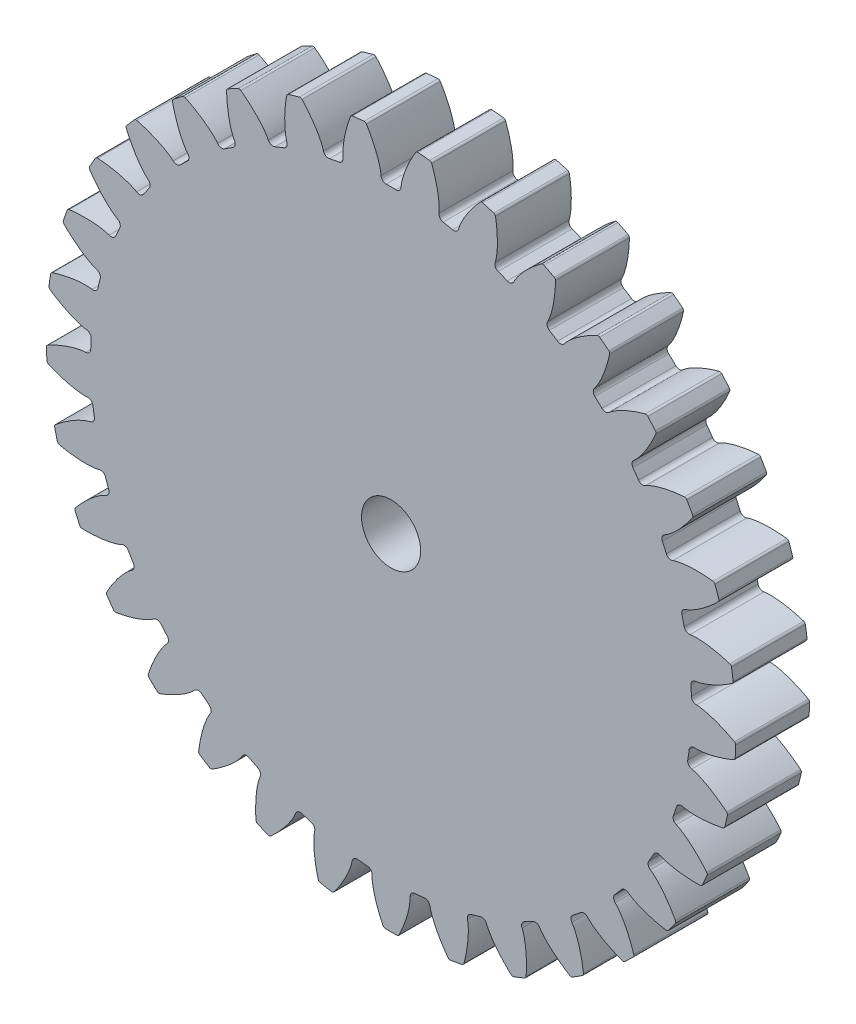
SolidWorks part; units mm, degrees
ref_plane "Front" through (0, 0, 0) normal (0, 0, 1) x (1, 0, 0)
ref_plane "Top" through (0, 0, 0) normal (0, 1, 0) x (1, 0, 0)
ref_plane "Right" through (0, 0, 0) normal (1, 0, 0) x (0, 0, -1)
sketch "Sketch1" plane through (0, 0, 0) normal (0, 0, 1) x (1, 0, 0)
  circle A0 centre (0, 0) radius 29.6333
extrude "Boss-Extrude1" add sketch "Sketch1" along normal blind 6.35
sketch "Sketch3" plane through (0, 0, 0) normal (0, 0, 1) x (1, 0, 0)
  line L0 (0, 0) -> (43.7181, 0) construction
  line L2 (0, 0) -> (-0.8442, 25.8095) construction
  line L3 (0, 0) -> (0.8442, 25.8095) construction
  line L4 (0.8442, 25.8095) -> (0.8583, 26.241) construction
  line L5 (0, 0) -> (0, 61.276) construction
  line L6 (-0.8442, 25.8095) -> (-0.8583, 26.241) construction
  circle A0 centre (0, 0) radius 29.6333 construction
  circle A1 centre (0, 0) radius 27.94 construction
  circle A2 centre (0, 0) radius 26.255 construction
  arc A3 (0.8442, 25.8095) -> (-0.8442, 25.8095) centre (0, 0) ccw construction
  arc A5 (2.1878, 29.5525) -> (-2.1878, 29.5525) centre (0, 0) ccw
  spline S0 degree 4 poles (-0.8583, 26.241) (-0.8585, 26.2463) (-0.8593, 26.2612) (-0.8616, 26.2893) (-0.8664, 26.3351) (-0.874, 26.3935) (-0.8855, 26.4688) (-0.9013, 26.5573) (-0.921, 26.6545) (-0.9449, 26.7599) (-0.9709, 26.865) (-0.999, 26.9696) (-1.0288, 27.0736) (-1.0671, 27.1993) (-1.1161, 27.3497) (-1.1778, 27.525) (-1.253, 27.7232) (-1.3352, 27.9245) (-1.4207, 28.1218) (-1.5123, 28.3205) (-1.6047, 28.5121) (-1.7061, 28.7103) (-1.8024, 28.8929) (-1.9163, 29.0964) (-2.0099, 29.2603) (-2.1397, 29.4754) (-2.2183, 29.6022) (-2.3124, 29.7501) (-2.3553, 29.8155) (-2.3818, 29.8559) knots 0 0 0 0 0 0.005377 0.015084 0.028532 0.04661 0.064855 0.092111 0.119476 0.146842 0.174209 0.201575 0.228941 0.256307 0.307035 0.361767 0.4165 0.471232 0.525964 0.580697 0.635429 0.690161 0.744894 0.799626 0.854358 0.909091 0.954545 1 1 1 1 1 construction
  spline S1 degree 4 poles (-0.8583, 26.241) (-0.8585, 26.2463) (-0.8593, 26.2612) (-0.8616, 26.2893) (-0.8664, 26.3351) (-0.874, 26.3935) (-0.8855, 26.4688) (-0.9013, 26.5573) (-0.921, 26.6545) (-0.9449, 26.7599) (-0.9709, 26.865) (-0.999, 26.9696) (-1.0288, 27.0736) (-1.0671, 27.1993) (-1.1161, 27.3497) (-1.1778, 27.525) (-1.253, 27.7232) (-1.3352, 27.9245) (-1.4207, 28.1218) (-1.5123, 28.3205) (-1.6047, 28.5121) (-1.7061, 28.7103) (-1.8024, 28.8929) (-1.9163, 29.0964) (-2.0099, 29.2603) (-2.1116, 29.4288) (-2.1618, 29.5107) (-2.1878, 29.5525) knots 0 0 0 0 0 0.005377 0.015084 0.028532 0.04661 0.064855 0.092111 0.119476 0.146842 0.174209 0.201575 0.228941 0.256307 0.307035 0.361767 0.4165 0.471232 0.525964 0.580697 0.635429 0.690161 0.744894 0.799626 0.854358 0.909091 0.909091 0.909091 0.909091 0.909091
  spline S2 degree 4 poles (0.8583, 26.241) (0.8585, 26.2463) (0.8593, 26.2612) (0.8616, 26.2893) (0.8664, 26.3351) (0.874, 26.3935) (0.8855, 26.4688) (0.9013, 26.5573) (0.921, 26.6545) (0.9449, 26.7599) (0.9709, 26.865) (0.999, 26.9696) (1.0288, 27.0736) (1.0671, 27.1993) (1.1161, 27.3497) (1.1778, 27.525) (1.253, 27.7232) (1.3352, 27.9245) (1.4207, 28.1218) (1.5123, 28.3205) (1.6047, 28.5121) (1.7061, 28.7103) (1.8024, 28.8929) (1.9163, 29.0964) (2.0099, 29.2603) (2.1397, 29.4754) (2.2183, 29.6022) (2.3124, 29.7501) (2.3553, 29.8155) (2.3818, 29.8559) knots 0 0 0 0 0 0.005377 0.015084 0.028532 0.04661 0.064855 0.092111 0.119476 0.146842 0.174209 0.201575 0.228941 0.256307 0.307035 0.361767 0.4165 0.471232 0.525964 0.580697 0.635429 0.690161 0.744894 0.799626 0.854358 0.909091 0.954545 1 1 1 1 1 construction
  spline S3 degree 4 poles (0.8583, 26.241) (0.8585, 26.2463) (0.8593, 26.2612) (0.8616, 26.2893) (0.8664, 26.3351) (0.874, 26.3935) (0.8855, 26.4688) (0.9013, 26.5573) (0.921, 26.6545) (0.9449, 26.7599) (0.9709, 26.865) (0.999, 26.9696) (1.0288, 27.0736) (1.0671, 27.1993) (1.1161, 27.3497) (1.1778, 27.525) (1.253, 27.7232) (1.3352, 27.9245) (1.4207, 28.1218) (1.5123, 28.3205) (1.6047, 28.5121) (1.7061, 28.7103) (1.8024, 28.8929) (1.9163, 29.0964) (2.0099, 29.2603) (2.1116, 29.4288) (2.1618, 29.5107) (2.1878, 29.5525) knots 0 0 0 0 0 0.005377 0.015084 0.028532 0.04661 0.064855 0.092111 0.119476 0.146842 0.174209 0.201575 0.228941 0.256307 0.307035 0.361767 0.4165 0.471232 0.525964 0.580697 0.635429 0.690161 0.744894 0.799626 0.854358 0.909091 0.909091 0.909091 0.909091 0.909091
sketch "DCLTBC" [suppressed] plane through (0, 0, 0) normal (0, 0, 1) x (1, 0, 0)
  line L0 (0, 0) -> (41.04, 0) construction
  line L1 (-0.5314, 3.7122) -> (-0.6658, 4.6511) construction
  line L2 (0.5314, 3.7122) -> (0.6658, 4.6511) construction
  line L3 (-0.5663, 3.9565) -> (-0.6658, 4.6511)
  line L4 (0.5663, 3.9565) -> (0.6658, 4.6511)
  line L5 (0, 0) -> (0, 104.9356) construction
  circle A0 centre (0, 0) radius 6
  circle A1 centre (0, 0) radius 5 construction
  circle A2 centre (0, 0) radius 4.6985 construction
  arc A3 (0.5314, 3.7122) -> (-0.5314, 3.7122) centre (0, 0) ccw construction
  arc A4 (0.2939, 3.7385) -> (-0.2939, 3.7385) centre (0, 0) ccw
  arc A5 (-0.5663, 3.9565) -> (-0.2939, 3.7385) centre (-0.3139, 3.9927) ccw
  arc A7 (0.5663, 3.9565) -> (0.2939, 3.7385) centre (0.3139, 3.9927) cw
  spline S0 degree 4 poles (-988.7304, -149.2706) (-11.6148, 2.2579) (-0.7472, 4.1012) (-0.605, 4.4173) (-0.6744, 4.689) (-0.6813, 4.7123) (-0.6912, 4.742) (-0.7043, 4.7767) (-0.7201, 4.8144) (-0.7387, 4.8549) (-0.7586, 4.8949) (-0.7796, 4.9342) (-0.8016, 4.973) (-0.8295, 5.0194) (-0.8647, 5.0743) (-0.9083, 5.1373) (-0.9607, 5.2072) (-1.0171, 5.2768) (-1.0751, 5.3439) (-1.1364, 5.4099) (-1.1978, 5.4726) (-1.2642, 5.5359) (-1.327, 5.5933) (-1.4002, 5.6556) (-1.7414, 5.9377) (-3.0864, 6.8476) (16.8835, -7.992) (-807.1576, 598.2098) knots -0.641464 -0.641464 -0.641464 -0.641464 -0.641464 0.005377 0.015084 0.028532 0.04661 0.064855 0.092111 0.119476 0.146842 0.174209 0.201575 0.228941 0.256307 0.307035 0.361767 0.4165 0.471232 0.525964 0.580697 0.635429 0.690161 0.744894 0.799626 0.854358 1.935774 1.935774 1.935774 1.935774 1.935774 only from (-0.6658, 4.6511) to (-1.5725, 5.7903) construction
  spline S1 degree 4 poles (988.7304, -149.2706) (11.6148, 2.2579) (0.7472, 4.1012) (0.605, 4.4173) (0.6744, 4.689) (0.6813, 4.7123) (0.6912, 4.742) (0.7043, 4.7767) (0.7201, 4.8144) (0.7387, 4.8549) (0.7586, 4.8949) (0.7796, 4.9342) (0.8016, 4.973) (0.8295, 5.0194) (0.8647, 5.0743) (0.9083, 5.1373) (0.9607, 5.2072) (1.0171, 5.2768) (1.0751, 5.3439) (1.1364, 5.4099) (1.1978, 5.4726) (1.2642, 5.5359) (1.327, 5.5933) (1.4002, 5.6556) (1.7414, 5.9377) (3.0864, 6.8476) (-16.8835, -7.992) (807.1576, 598.2098) knots -0.641464 -0.641464 -0.641464 -0.641464 -0.641464 0.005377 0.015084 0.028532 0.04661 0.064855 0.092111 0.119476 0.146842 0.174209 0.201575 0.228941 0.256307 0.307035 0.361767 0.4165 0.471232 0.525964 0.580697 0.635429 0.690161 0.744894 0.799626 0.854358 1.935774 1.935774 1.935774 1.935774 1.935774 only from (0.6658, 4.6511) to (1.5725, 5.7903) construction
  spline S2 degree 4 poles (-0.6658, 4.6511) (-0.6661, 4.6532) (-0.6672, 4.6593) (-0.6697, 4.6706) (-0.6744, 4.689) (-0.6813, 4.7123) (-0.6912, 4.742) (-0.7043, 4.7767) (-0.7201, 4.8144) (-0.7387, 4.8549) (-0.7586, 4.8949) (-0.7796, 4.9342) (-0.8016, 4.973) (-0.8295, 5.0194) (-0.8647, 5.0743) (-0.9083, 5.1373) (-0.9607, 5.2072) (-1.0171, 5.2768) (-1.0751, 5.3439) (-1.1364, 5.4099) (-1.1978, 5.4726) (-1.2642, 5.5359) (-1.327, 5.5933) (-1.4002, 5.6556) (-1.4602, 5.7051) (-1.5245, 5.7545) (-1.5562, 5.7782) (-1.5725, 5.7903) knots 0 0 0 0 0 0.005377 0.015084 0.028532 0.04661 0.064855 0.092111 0.119476 0.146842 0.174209 0.201575 0.228941 0.256307 0.307035 0.361767 0.4165 0.471232 0.525964 0.580697 0.635429 0.690161 0.744894 0.799626 0.854358 0.909091 0.909091 0.909091 0.909091 0.909091
  spline S3 degree 4 poles (0.6658, 4.6511) (0.6661, 4.6532) (0.6672, 4.6593) (0.6697, 4.6706) (0.6744, 4.689) (0.6813, 4.7123) (0.6912, 4.742) (0.7043, 4.7767) (0.7201, 4.8144) (0.7387, 4.8549) (0.7586, 4.8949) (0.7796, 4.9342) (0.8016, 4.973) (0.8295, 5.0194) (0.8647, 5.0743) (0.9083, 5.1373) (0.9607, 5.2072) (1.0171, 5.2768) (1.0751, 5.3439) (1.1364, 5.4099) (1.1978, 5.4726) (1.2642, 5.5359) (1.327, 5.5933) (1.4002, 5.6556) (1.4602, 5.7051) (1.5245, 5.7545) (1.5562, 5.7782) (1.5725, 5.7903) knots 0 0 0 0 0 0.005377 0.015084 0.028532 0.04661 0.064855 0.092111 0.119476 0.146842 0.174209 0.201575 0.228941 0.256307 0.307035 0.361767 0.4165 0.471232 0.525964 0.580697 0.635429 0.690161 0.744894 0.799626 0.854358 0.909091 0.909091 0.909091 0.909091 0.909091
extrude "Cut-Extrude-DCLTBC" [suppressed] cut sketch "DCLTBC" along normal through all contours L4 S3 A0 S2 L3 A5 A4 A7
fillet "Fillet-DCLTBC" [suppressed] radius 0.2159
pattern_circular "CirPattern-DCLTBC" [suppressed] count 33 over 360
sketch "DCGTBC" plane through (0, 0, 0) normal (0, 0, 1) x (1, 0, 0)
  line L0 (0, 0) -> (41.04, 0) construction
  line L5 (0, 0) -> (0, 104.9356) construction
  circle A0 centre (0, 0) radius 29.6333
  circle A1 centre (0, 0) radius 27.94 construction
  circle A2 centre (0, 0) radius 26.255 construction
  arc A3 (0.8442, 25.8095) -> (-0.8442, 25.8095) centre (0, 0) ccw construction
  arc A5 (0.4196, 25.8199) -> (0.8581, 26.2364) centre (0.4266, 26.2516) ccw
  arc A7 (-0.8581, 26.2364) -> (-0.4196, 25.8199) centre (-0.4266, 26.2516) ccw
  arc A11 (0.4196, 25.8199) -> (-0.4196, 25.8199) centre (0, 0) ccw
  spline S2 degree 4 poles (-999.2499, -29.7039) (-13.4373, 24.1463) (-1.0154, 25.1147) (-0.8034, 25.7297) (-0.8664, 26.3351) (-0.874, 26.3935) (-0.8855, 26.4688) (-0.9013, 26.5573) (-0.921, 26.6545) (-0.9449, 26.7599) (-0.9709, 26.865) (-0.999, 26.9696) (-1.0288, 27.0736) (-1.0671, 27.1993) (-1.1161, 27.3497) (-1.1778, 27.525) (-1.253, 27.7232) (-1.3352, 27.9245) (-1.4207, 28.1218) (-1.5123, 28.3205) (-1.6047, 28.5121) (-1.7061, 28.7103) (-1.8024, 28.8929) (-1.9163, 29.0964) (-2.3591, 29.8718) (-3.9005, 32.2305) (12.7393, 5.2217) (-530.3139, 878.7135) knots -0.569004 -0.569004 -0.569004 -0.569004 -0.569004 0.005377 0.015084 0.028532 0.04661 0.064855 0.092111 0.119476 0.146842 0.174209 0.201575 0.228941 0.256307 0.307035 0.361767 0.4165 0.471232 0.525964 0.580697 0.635429 0.690161 0.744894 0.799626 0.854358 1.725641 1.725641 1.725641 1.725641 1.725641 only from (-0.8583, 26.241) to (-2.1878, 29.5525) construction
  spline S3 degree 4 poles (999.2499, -29.7039) (13.4373, 24.1463) (1.0154, 25.1147) (0.8034, 25.7297) (0.8664, 26.3351) (0.874, 26.3935) (0.8855, 26.4688) (0.9013, 26.5573) (0.921, 26.6545) (0.9449, 26.7599) (0.9709, 26.865) (0.999, 26.9696) (1.0288, 27.0736) (1.0671, 27.1993) (1.1161, 27.3497) (1.1778, 27.525) (1.253, 27.7232) (1.3352, 27.9245) (1.4207, 28.1218) (1.5123, 28.3205) (1.6047, 28.5121) (1.7061, 28.7103) (1.8024, 28.8929) (1.9163, 29.0964) (2.3591, 29.8718) (3.9005, 32.2305) (-12.7393, 5.2217) (530.3139, 878.7135) knots -0.569004 -0.569004 -0.569004 -0.569004 -0.569004 0.005377 0.015084 0.028532 0.04661 0.064855 0.092111 0.119476 0.146842 0.174209 0.201575 0.228941 0.256307 0.307035 0.361767 0.4165 0.471232 0.525964 0.580697 0.635429 0.690161 0.744894 0.799626 0.854358 1.725641 1.725641 1.725641 1.725641 1.725641 only from (0.8583, 26.241) to (2.1878, 29.5525) construction
  spline S4 degree 4 poles (-0.8581, 26.2364) (-0.8583, 26.2428) (-0.8591, 26.2589) (-0.8615, 26.2882) (-0.8664, 26.3351) (-0.874, 26.3935) (-0.8855, 26.4688) (-0.9013, 26.5573) (-0.921, 26.6545) (-0.9449, 26.7599) (-0.9709, 26.865) (-0.999, 26.9696) (-1.0288, 27.0736) (-1.0671, 27.1993) (-1.1161, 27.3497) (-1.1778, 27.525) (-1.253, 27.7232) (-1.3352, 27.9245) (-1.4207, 28.1218) (-1.5123, 28.3205) (-1.6047, 28.5121) (-1.7061, 28.7103) (-1.8024, 28.8929) (-1.9163, 29.0964) (-2.0099, 29.2603) (-2.1116, 29.4288) (-2.1618, 29.5107) (-2.1878, 29.5525) knots -0.001165 -0.001165 -0.001165 -0.001165 -0.001165 0.005377 0.015084 0.028532 0.04661 0.064855 0.092111 0.119476 0.146842 0.174209 0.201575 0.228941 0.256307 0.307035 0.361767 0.4165 0.471232 0.525964 0.580697 0.635429 0.690161 0.744894 0.799626 0.854358 0.909091 0.909091 0.909091 0.909091 0.909091
  spline S5 degree 4 poles (0.8581, 26.2364) (0.8583, 26.2428) (0.8591, 26.2589) (0.8615, 26.2882) (0.8664, 26.3351) (0.874, 26.3935) (0.8855, 26.4688) (0.9013, 26.5573) (0.921, 26.6545) (0.9449, 26.7599) (0.9709, 26.865) (0.999, 26.9696) (1.0288, 27.0736) (1.0671, 27.1993) (1.1161, 27.3497) (1.1778, 27.525) (1.253, 27.7232) (1.3352, 27.9245) (1.4207, 28.1218) (1.5123, 28.3205) (1.6047, 28.5121) (1.7061, 28.7103) (1.8024, 28.8929) (1.9163, 29.0964) (2.0099, 29.2603) (2.1116, 29.4288) (2.1618, 29.5107) (2.1878, 29.5525) knots -0.001165 -0.001165 -0.001165 -0.001165 -0.001165 0.005377 0.015084 0.028532 0.04661 0.064855 0.092111 0.119476 0.146842 0.174209 0.201575 0.228941 0.256307 0.307035 0.361767 0.4165 0.471232 0.525964 0.580697 0.635429 0.690161 0.744894 0.799626 0.854358 0.909091 0.909091 0.909091 0.909091 0.909091
extrude "Cut-Extrude-DCGTBC" cut sketch "DCGTBC" along normal through all contours A5 S5 A0 S4 A7 A11
fillet "Fillet-DCGTBC" radius 0.2159 2 edges at (2.1878, 29.5525, 3.175) (-2.1878, 29.5525, 3.175)
pattern_circular "CirPattern-DCGTBC" count 33 over 360 about axis through (0, 0, 6.35) along (0, 0, 1) of "Cut-Extrude-DCGTBC", "Fillet-DCGTBC"
sketch "Sketch4" plane through (0, 0, 6.35) normal (0, 0, 1) x (1, 0, 0)
  circle A0 centre (0, 0) radius 2.54
  dimension "D1" = 5.08
extrude "Cut-Extrude2" cut sketch "Sketch4" against normal through all
equation "\"DiametralPitch\" = 15'Diametral Pitch"
equation "\"NumTeeth\"= 33'Number of Teeth"
equation "\"PressureAngle\"= 20deg'Pressure Angle"
equation "\"Addendum\"= 1 / \"DiametralPitch\"'Addendum"
equation "\"Dedendum\"= 1.25 / \"DiametralPitch\"'Dedendum"
equation "\"WorkingDepth\"= 2 / \"DiametralPitch\"'Working Depth - here for REF (Not used in building model)"
equation "\"WholeDepth\"= 2.25 / \"DiametralPitch\"'Whole Depth - here for REF (Not used in building model)"
equation "\"Clearance\"= .19 / \"DiametralPitch\"'Clearance"
equation "\"CircularPitch\"= pi / \"DiametralPitch\"'Circular Pitch - here for REF (Not used in building model)"
equation "\"PitchCircle\"= \"NumTeeth\" / \"DiametralPitch\"'Pitch Circle - or - Pitch Diameter"
equation "\"OutsideDiameter\"= ( \"NumTeeth\" + 2 ) / \"DiametralPitch\"'Outside Diameter"
equation "\"Fillet\"= \"Clearance\" * cos ( \"PressureAngle\" ) * tan ( ( 90 + \"PressureAngle\" ) / 2 )'Fillet"
equation "\"AddendumCircle\"= \"PitchCircle\" + ( 2 * \"Addendum\" )'Addendum Circle - or - Addendum Diameter"
equation "\"DedendumCircle\"= \"PitchCircle\" - ( 2 * \"Dedendum\" )'Dedendum Circle - or - Dedendum Diameter"
equation "\"BaseCircle\"= \"PitchCircle\" * cos ( \"PressureAngle\" )'Base Circle - Base Diameter"
equation "\"PitchAngle\"= 360deg / \"NumTeeth\"'Pitch Angle"
equation "\"Alpha\"= sqr ( \"PitchCircle\" ^ 2 - \"BaseCircle\" ^ 2 ) / \"BaseCircle\" * 180 / PI - \"PressureAngle\"'Alpha - Used for Calculating Beta"
equation "\"Beta\"= ( \"PitchAngle\" / 4 - ( \"Alpha\" - 90 ) )'Beta - Used in definition of the parameters for the parametric equation driven curve"
equation "\"Gamma\"= ( \"PitchAngle\" / 4 - ( \"Alpha\" + 90 ) )'Gamma - Used in definition of the parameters for the parametric equation driven curve"
equation "\"Phi\"= sqr ( ( \"AddendumCircle\" / 2 ) ^ 2 - ( \"BaseCircle\" / 2 ) ^ 2 ) / ( \"BaseCircle\" / 2 )'Phi - Used in definition of the parameters for the parametric equation driven curve"
equation "\"DCGTBC\"= iif ( ( \"DedendumCircle\" + ( \"Fillet\" * 2 ) ) > \"BaseCircle\" , \"unsuppressed\" , \"suppressed\" )'if Dedendum Circle +2X Fillet IS GREATER THAN BaseCircle THEN Unsuppress OR Suppress FEATURE"
equation "\"DCLTBC\"= iif ( ( \"DedendumCircle\" + ( \"Fillet\" * 2 ) ) > \"BaseCircle\" , \"suppressed\" , \"unsuppressed\" )'if Dedendum Circle +2X Fillet IS GREATER THAN BaseCircle THEN Suppress OR Unsuppress FEATURE"
equation "\"Cut-Extrude-DCGTBC\"= iif ( ( \"DedendumCircle\" + ( \"Fillet\" * 2 ) ) > \"BaseCircle\" , \"unsuppressed\" , \"suppressed\" )'if Dedendum Circle +2X Fillet IS GREATER THAN BaseCircle THEN UnsuppressORSuppress "
equation "\"Cut-Extrude-DCLTBC\"= iif ( ( \"DedendumCircle\" + ( \"Fillet\" * 2 ) ) > \"BaseCircle\" , \"suppressed\" , \"unsuppressed\" )'if Dedendum Circle +2X Fillet IS GREATER THAN BaseCircle THEN SuppressORUnsuppress "
equation "\"CirPattern-DCGTBC\"= iif ( ( \"DedendumCircle\" + ( \"Fillet\" * 2 ) ) > \"BaseCircle\" , \"unsuppressed\" , \"suppressed\" )'if Dedendum Circle +2X Fillet IS GREATER THAN \"BaseCircle\" THEN UnsuppressORSuppress"
equation "\"CirPattern-DCLTBC\"= iif ( ( \"DedendumCircle\" + ( \"Fillet\" * 2 ) ) > \"BaseCircle\" , \"suppressed\" , \"unsuppressed\" )'if Dedendum Circle +2X Fillet IS GREATER THAN \"BaseCircle\" THEN SuppressORUnsuppress"
equation "\"Fillet-DCGTBC\"= iif ( ( \"DedendumCircle\" + ( \"Fillet\" * 2 ) ) > \"BaseCircle\" , \"unsuppressed\" , \"suppressed\" )'if Dedendum Circle +2X Fillet IS GREATER THAN \"BaseCircle\" THEN UnsuppressORSuppress FEA"
equation "\"Fillet-DCLTBC\"= iif ( ( \"DedendumCircle\" + ( \"Fillet\" * 2 ) ) > \"BaseCircle\" , \"suppressed\" , \"unsuppressed\" )'if Dedendum Circle +2X Fillet IS GREATER THAN \"BaseCircle\" THEN SuppressORUnsuppress FEA"
equation "\"D1@CirPattern-DCGTBC\"=\"NumTeeth\""
equation "\"D1@CirPattern-DCLTBC\"=\"NumTeeth\""
equation "\"D1@DCGTBC\"=\"Fillet\""
equation "\"D1@DCLTBC\"=\"Fillet\""
equation "\"D1@Fillet-DCLTBC\"=\"Fillet\"/2"
equation "\"D1@Fillet-DCGTBC\"=\"Fillet\"/2"
